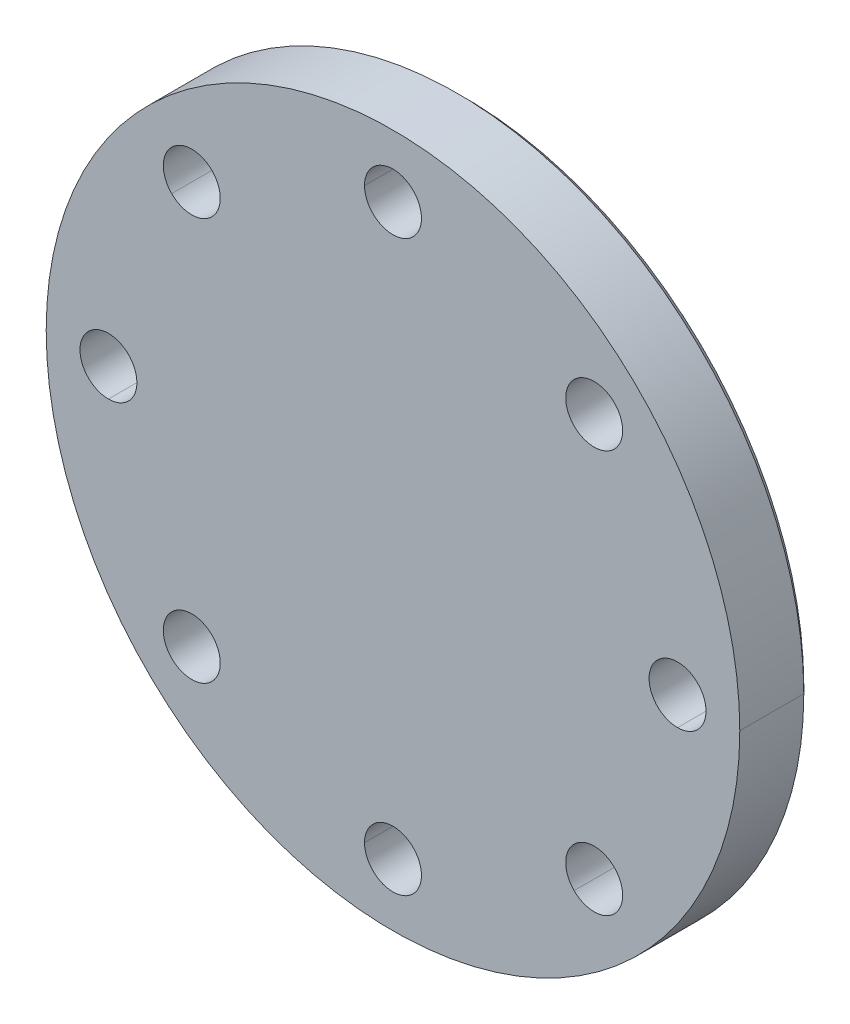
SolidWorks part; units mm, degrees
ref_plane "Front Plane" through (0, 0, 0) normal (0, 0, 1) x (1, 0, 0)
ref_plane "Top Plane" through (0, 0, 0) normal (0, 1, 0) x (1, 0, 0)
ref_plane "Right Plane" through (0, 0, 0) normal (1, 0, 0) x (0, 0, -1)
body saved out of another part "Stock-XM,H-430_idler.stp-1"
